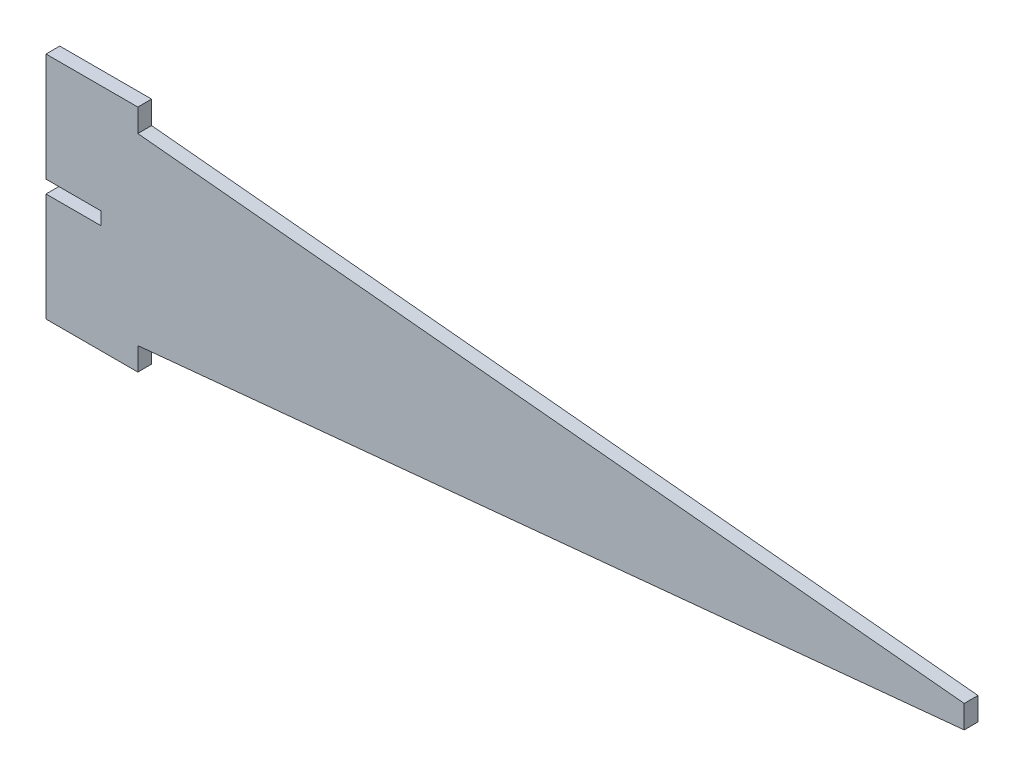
SolidWorks part; units mm, degrees
ref_plane "Alzado" through (0, 0, 0) normal (0, 0, 1) x (1, 0, 0)
ref_plane "Planta" through (0, 0, 0) normal (0, 1, 0) x (1, 0, 0)
ref_plane "Vista lateral" through (0, 0, 0) normal (1, 0, 0) x (0, 0, -1)
sketch "Croquis1" plane through (0, 0, 0) normal (0, 0, 1) x (1, 0, 0)
  line L0 (-12, -25) -> (-12, -1.4)
  line L1 (-12, 25) -> (8, 25)
  line L2 (8, 25) -> (8, 20)
  line L3 (8, 20) -> (188, 2.5)
  line L4 (188, 2.5) -> (188, -2.5)
  line L5 (0, 0) -> (21.7862, 0) construction
  line L7 (8, -25) -> (8, -20)
  line L8 (-12, -25) -> (8, -25)
  line L25 (8, -20) -> (188, -2.5)
  line L26 (-12, 1.4) -> (-12, 25)
  line L27 (-12, -1.4) -> (0, -1.4)
  line L29 (-12, 1.4) -> (0, 1.4)
  line L30 (0, -1.4) -> (0, 1.4)
  point P9 (188, 0)
  point P16 (0, 0)
  dimension "D1" = 200
  dimension "D2" = 50
  dimension "D3" = 20
  dimension "D4" = 40
  dimension "D5" = 5
  dimension "D6" = 2.8
  dimension "D7" = 12
extrude "Saliente-Extruir1" add sketch "Croquis1" along normal blind 3
